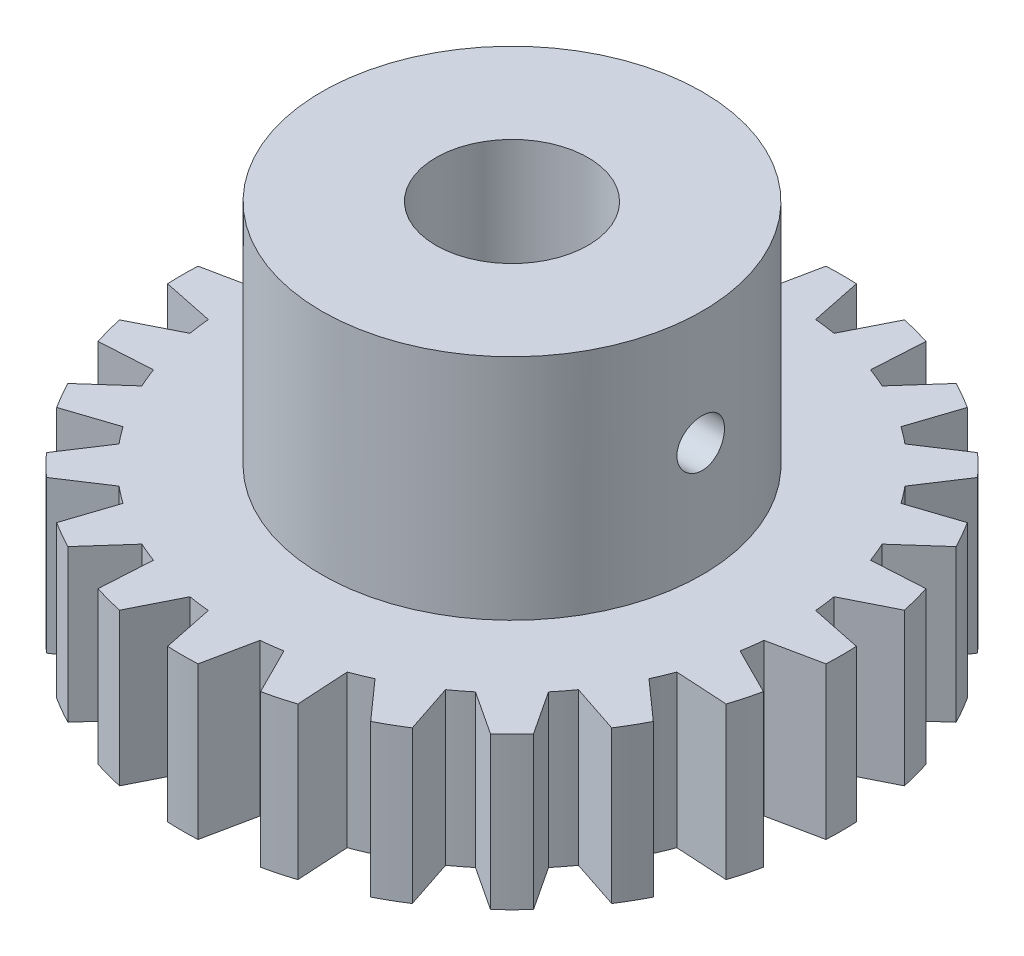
SolidWorks part; units mm, degrees
ref_plane "Front Plane" through (0, 0, 0) normal (0, 0, 1) x (1, 0, 0)
ref_plane "Top Plane" through (0, 0, 0) normal (0, 1, 0) x (1, 0, 0)
ref_plane "Right Plane" through (0, 0, 0) normal (1, 0, 0) x (0, 0, -1)
sketch "Sketch1" plane through (0, 0, 0) normal (0, 1, 0) x (1, 0, 0)
  line L0 (-0.635, 13.7394) -> (-1.0781, 11.5959)
  line L1 (0.635, 13.7394) -> (1.0781, 11.5959)
  line L2 (4.1694, 13.1069) -> (4.0426, 10.9217)
  line L3 (2.9427, 13.4356) -> (1.9598, 11.4798)
  line L4 (7.4196, 11.5812) -> (6.7316, 9.5033)
  line L5 (6.3198, 12.2162) -> (4.8643, 10.5814)
  line L6 (10.1643, 9.2662) -> (8.9619, 7.4372)
  line L7 (9.2662, 10.1643) -> (7.4372, 8.9619)
  line L8 (12.2162, 6.3198) -> (10.5814, 4.8643)
  line L9 (11.5812, 7.4196) -> (9.5033, 6.7316)
  line L10 (13.4356, 2.9427) -> (11.4798, 1.9598)
  line L11 (13.1069, 4.1694) -> (10.9217, 4.0426)
  line L12 (13.7394, -0.635) -> (11.5959, -1.0781)
  line L13 (13.7394, 0.635) -> (11.5959, 1.0781)
  line L14 (13.1069, -4.1694) -> (10.9217, -4.0426)
  line L15 (13.4356, -2.9427) -> (11.4798, -1.9598)
  line L16 (11.5812, -7.4196) -> (9.5033, -6.7316)
  line L17 (12.2162, -6.3198) -> (10.5814, -4.8643)
  line L18 (9.2662, -10.1643) -> (7.4372, -8.9619)
  line L19 (10.1643, -9.2662) -> (8.9619, -7.4372)
  line L20 (6.3198, -12.2162) -> (4.8643, -10.5814)
  line L21 (7.4196, -11.5812) -> (6.7316, -9.5033)
  line L22 (2.9427, -13.4356) -> (1.9598, -11.4798)
  line L23 (4.1694, -13.1069) -> (4.0426, -10.9217)
  line L24 (-0.635, -13.7394) -> (-1.0781, -11.5959)
  line L25 (0.635, -13.7394) -> (1.0781, -11.5959)
  line L26 (-4.1694, -13.1069) -> (-4.0426, -10.9217)
  line L27 (-2.9427, -13.4356) -> (-1.9598, -11.4798)
  line L28 (-7.4196, -11.5812) -> (-6.7316, -9.5033)
  line L29 (-6.3198, -12.2162) -> (-4.8643, -10.5814)
  line L30 (-10.1643, -9.2662) -> (-8.9619, -7.4372)
  line L31 (-9.2662, -10.1643) -> (-7.4372, -8.9619)
  line L32 (-12.2162, -6.3198) -> (-10.5814, -4.8643)
  line L33 (-11.5812, -7.4196) -> (-9.5033, -6.7316)
  line L34 (-13.4356, -2.9427) -> (-11.4798, -1.9598)
  line L35 (-13.1069, -4.1694) -> (-10.9217, -4.0426)
  line L36 (-13.7394, 0.635) -> (-11.5959, 1.0781)
  line L37 (-13.7394, -0.635) -> (-11.5959, -1.0781)
  line L38 (-13.1069, 4.1694) -> (-10.9217, 4.0426)
  line L39 (-13.4356, 2.9427) -> (-11.4798, 1.9598)
  line L40 (-11.5812, 7.4196) -> (-9.5033, 6.7316)
  line L41 (-12.2162, 6.3198) -> (-10.5814, 4.8643)
  line L42 (-9.2662, 10.1643) -> (-7.4372, 8.9619)
  line L43 (-10.1643, 9.2662) -> (-8.9619, 7.4372)
  line L44 (-6.3198, 12.2162) -> (-4.8643, 10.5814)
  line L45 (-7.4196, 11.5812) -> (-6.7316, 9.5033)
  line L46 (-2.9427, 13.4356) -> (-1.9598, 11.4798)
  line L47 (-4.1694, 13.1069) -> (-4.0426, 10.9217)
  circle A0 centre (0, 0) radius 11.6459 construction
  circle A1 centre (0, 0) radius 3.175
  circle A2 centre (0, 0) radius 13.7541 construction
  circle A3 centre (0, 0) radius 12.7 construction
  arc A4 (-0.635, 13.7394) -> (0.635, 13.7394) centre (0, 0) cw
  arc A5 (1.0781, 11.5959) -> (1.9598, 11.4798) centre (0, 0) cw
  arc A6 (4.0426, 10.9217) -> (4.8643, 10.5814) centre (0, 0) cw
  arc A7 (2.9427, 13.4356) -> (4.1694, 13.1069) centre (0, 0) cw
  arc A8 (6.7316, 9.5033) -> (7.4372, 8.9619) centre (0, 0) cw
  arc A9 (6.3198, 12.2162) -> (7.4196, 11.5812) centre (0, 0) cw
  arc A10 (8.9619, 7.4372) -> (9.5033, 6.7316) centre (0, 0) cw
  arc A11 (9.2662, 10.1643) -> (10.1643, 9.2662) centre (0, 0) cw
  arc A12 (10.5814, 4.8643) -> (10.9217, 4.0426) centre (0, 0) cw
  arc A13 (11.5812, 7.4196) -> (12.2162, 6.3198) centre (0, 0) cw
  arc A14 (11.4798, 1.9598) -> (11.5959, 1.0781) centre (0, 0) cw
  arc A15 (13.1069, 4.1694) -> (13.4356, 2.9427) centre (0, 0) cw
  arc A16 (11.5959, -1.0781) -> (11.4798, -1.9598) centre (0, 0) cw
  arc A17 (13.7394, 0.635) -> (13.7394, -0.635) centre (0, 0) cw
  arc A18 (10.9217, -4.0426) -> (10.5814, -4.8643) centre (0, 0) cw
  arc A19 (13.4356, -2.9427) -> (13.1069, -4.1694) centre (0, 0) cw
  arc A20 (9.5033, -6.7316) -> (8.9619, -7.4372) centre (0, 0) cw
  arc A21 (12.2162, -6.3198) -> (11.5812, -7.4196) centre (0, 0) cw
  arc A22 (7.4372, -8.9619) -> (6.7316, -9.5033) centre (0, 0) cw
  arc A23 (10.1643, -9.2662) -> (9.2662, -10.1643) centre (0, 0) cw
  arc A24 (4.8643, -10.5814) -> (4.0426, -10.9217) centre (0, 0) cw
  arc A25 (7.4196, -11.5812) -> (6.3198, -12.2162) centre (0, 0) cw
  arc A26 (1.9598, -11.4798) -> (1.0781, -11.5959) centre (0, 0) cw
  arc A27 (4.1694, -13.1069) -> (2.9427, -13.4356) centre (0, 0) cw
  arc A28 (-1.0781, -11.5959) -> (-1.9598, -11.4798) centre (0, 0) cw
  arc A29 (0.635, -13.7394) -> (-0.635, -13.7394) centre (0, 0) cw
  arc A30 (-4.0426, -10.9217) -> (-4.8643, -10.5814) centre (0, 0) cw
  arc A31 (-2.9427, -13.4356) -> (-4.1694, -13.1069) centre (0, 0) cw
  arc A32 (-6.7316, -9.5033) -> (-7.4372, -8.9619) centre (0, 0) cw
  arc A33 (-6.3198, -12.2162) -> (-7.4196, -11.5812) centre (0, 0) cw
  arc A34 (-8.9619, -7.4372) -> (-9.5033, -6.7316) centre (0, 0) cw
  arc A35 (-9.2662, -10.1643) -> (-10.1643, -9.2662) centre (0, 0) cw
  arc A36 (-10.5814, -4.8643) -> (-10.9217, -4.0426) centre (0, 0) cw
  arc A37 (-11.5812, -7.4196) -> (-12.2162, -6.3198) centre (0, 0) cw
  arc A38 (-11.4798, -1.9598) -> (-11.5959, -1.0781) centre (0, 0) cw
  arc A39 (-13.1069, -4.1694) -> (-13.4356, -2.9427) centre (0, 0) cw
  arc A40 (-11.5959, 1.0781) -> (-11.4798, 1.9598) centre (0, 0) cw
  arc A41 (-13.7394, -0.635) -> (-13.7394, 0.635) centre (0, 0) cw
  arc A42 (-10.9217, 4.0426) -> (-10.5814, 4.8643) centre (0, 0) cw
  arc A43 (-13.4356, 2.9427) -> (-13.1069, 4.1694) centre (0, 0) cw
  arc A44 (-9.5033, 6.7316) -> (-8.9619, 7.4372) centre (0, 0) cw
  arc A45 (-12.2162, 6.3198) -> (-11.5812, 7.4196) centre (0, 0) cw
  arc A46 (-7.4372, 8.9619) -> (-6.7316, 9.5033) centre (0, 0) cw
  arc A47 (-10.1643, 9.2662) -> (-9.2662, 10.1643) centre (0, 0) cw
  arc A48 (-4.8643, 10.5814) -> (-4.0426, 10.9217) centre (0, 0) cw
  arc A49 (-7.4196, 11.5812) -> (-6.3198, 12.2162) centre (0, 0) cw
  arc A50 (-1.9598, 11.4798) -> (-1.0781, 11.5959) centre (0, 0) cw
  arc A51 (-4.1694, 13.1069) -> (-2.9427, 13.4356) centre (0, 0) cw
  point P6 (0, 13.7541)
  point P130 (0, 0)
  dimension "D1" = 25.4
  dimension "D2" = 27.5082
  dimension "D3" = 23.2918
  dimension "D4" = 6.35
  dimension "D5" = 1.27
extrude "Boss-Extrude1" add sketch "Sketch1" along normal blind 6.35
sketch "Sketch2" plane through (0, 6.35, 0) normal (0, 1, 0) x (1, 0, 0)
  circle A0 centre (0, 0) radius 3.175
  circle A1 centre (0, 0) radius 7.9375
  dimension "D1" = 15.875
extrude "Boss-Extrude2" add sketch "Sketch2" along normal blind 9.525
sketch "Sketch3" plane through (0, 0, 0) normal (1, 0, 0) x (0, 0, -1)
  line L0 (7.9375, 6.35) -> (7.9375, 15.875) construction
  circle A0 centre (0, 11.1125) radius 0.9922
  point P2 (0, 0)
  point P5 (7.9375, 11.1125)
  dimension "D1" = 1.9844
extrude "Cut-Extrude1" cut sketch "Sketch3" against normal through all both and the other way through all
